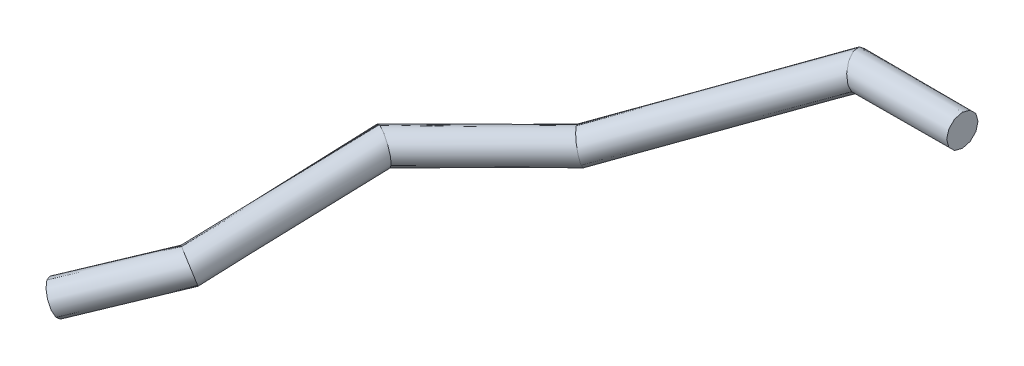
SolidWorks part; units mm, degrees
ref_plane "Ebene vorne" through (0, 0, 0) normal (0, 0, 1) x (1, 0, 0)
ref_plane "Ebene oben" through (0, 0, 0) normal (0, 1, 0) x (1, 0, 0)
ref_plane "Ebene rechts" through (0, 0, 0) normal (1, 0, 0) x (0, 0, -1)
sketch3d "3D-Skizze1"
  line L0 (-270.4031, -207.8738, 286.3194) -> (-224.9173, -185.1308, 254.4793)
  line L1 (-224.9173, -185.1308, 254.4793) -> (-208.5965, -165, 159.099)
  line L2 (-208.5965, -165, 159.099) -> (-152.028, -165, 102.5305)
  line L3 (-194.4544, -165, 144.9569) -> (-166.1701, -165, 116.6726) construction
  line L4 (-152.028, -165, 102.5305) -> (-60, -115, 35)
  line L6 (-60, -115, 35) -> (0, -115, 35)
  line L7 (-270.4031, -207.8738, 286.3194) -> (-240.0792, -192.7118, 265.0927) construction
  line L8 (-40, -115, 35) -> (0, -115, 35) construction
  dimension "D1" = 20
  dimension "D2" = 20
  dimension "D3" = 20
  dimension "D4" = 20
ref_plane "Ebene1" through (0, -115, 35) normal (1, 0, 0) x (0, 0, -1)
sketch "Skizze1" plane through (0, -115, 35) normal (1, 0, 0) x (0, 0, -1)
  circle A0 centre (0, 0) radius 9
  dimension "D1" = 18
sweep "Austragung1" add profiles "Skizze1" path "3D-Skizze1"
equation "\"Breite\"=25"
equation "\"Wandstärke\"=2"
